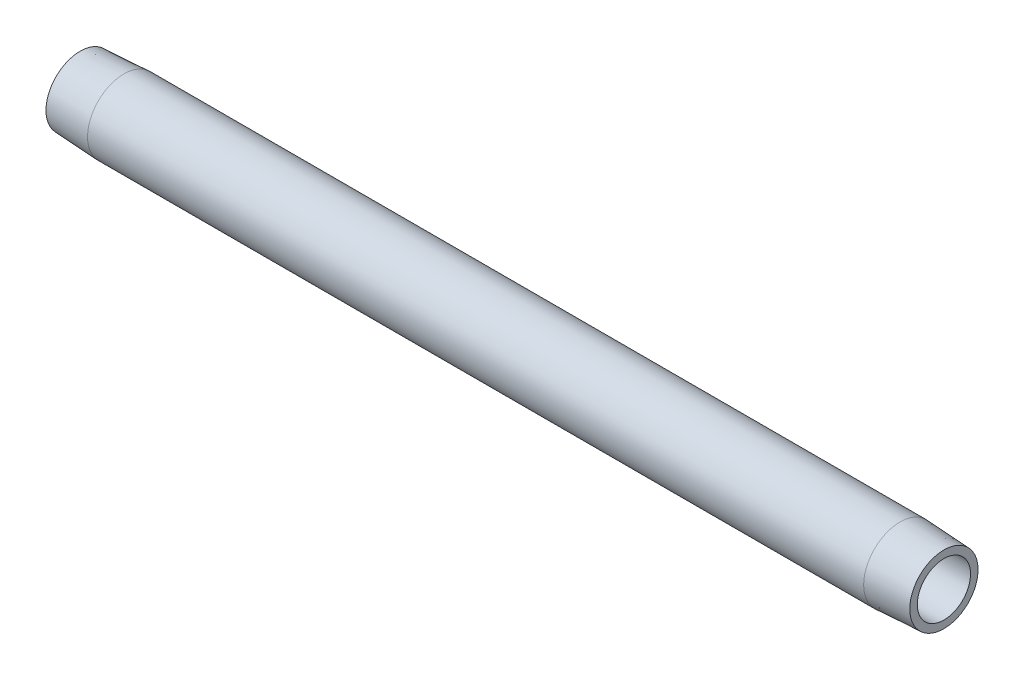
SolidWorks part; units mm, degrees
ref_plane "Front Plane" through (0, 0, 0) normal (0, 0, 1) x (1, 0, 0)
ref_plane "Top Plane" through (0, 0, 0) normal (0, 1, 0) x (1, 0, 0)
ref_plane "Right Plane" through (0, 0, 0) normal (1, 0, 0) x (0, 0, -1)
sketch "Sketch1" plane through (0, 0, 0) normal (0, 0, 1) x (1, 0, 0)
  line L5 (203.2, 6.2611) -> (0, 6.2611)
  line L6 (192.8876, 8.5725) -> (10.3124, 8.5725)
  line L7 (10.3124, 8.5725) -> (0, 8.0321)
  line L8 (203.2, 8.0321) -> (192.8876, 8.5725)
  line L9 (203.2, 6.2611) -> (203.2, 8.0321)
  line L10 (0, 6.2611) -> (0, 8.0321)
  line L11 (0, 0) -> (50000, 0) construction
  line L12 (0, -55) -> (0, 55) construction
  dimension "D1" = 12.5222
  dimension "D2" = 17.145
  dimension "D3" = 3
  dimension "D4" = 3
  dimension "D5" = 203.2
  dimension "D6" = 10.3124
  dimension "D7" = 10.3124
revolve "Revolve1" add sketch "Sketch1" angle 360 about L11
